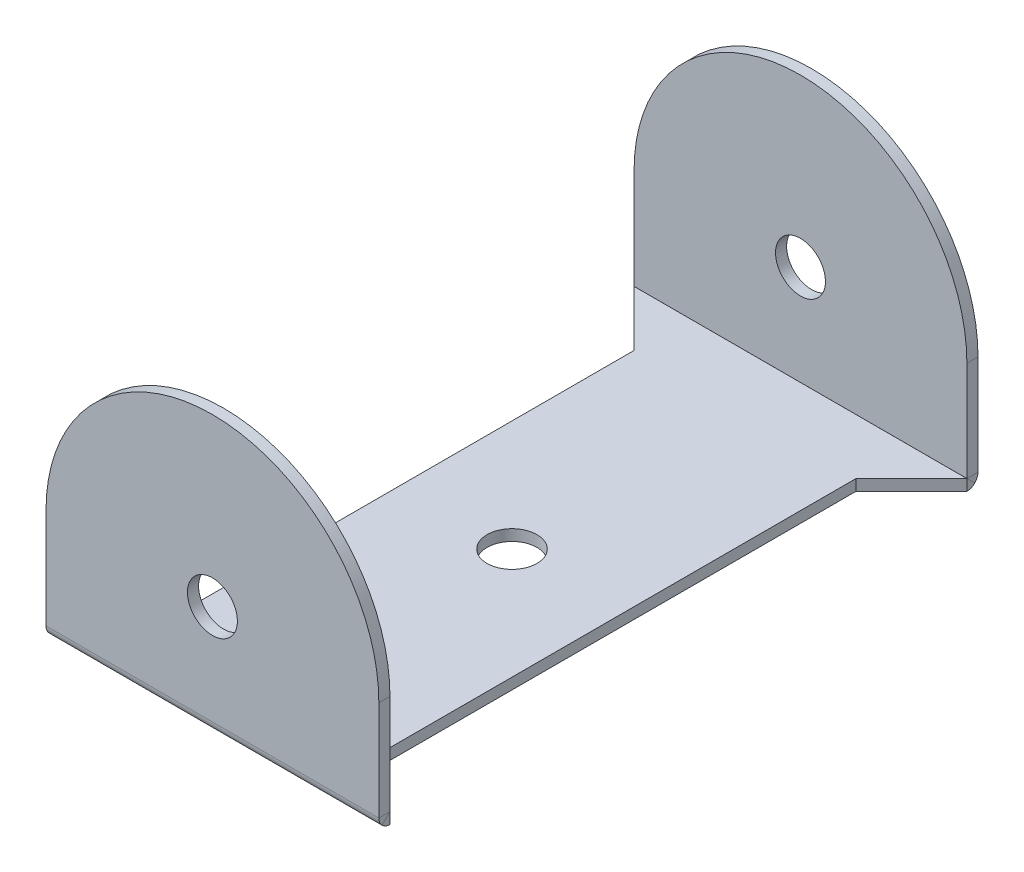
SolidWorks part; units mm, degrees
ref_plane "Front Plane" through (0, 0, 0) normal (0, 0, 1) x (1, 0, 0)
ref_plane "Top Plane" through (0, 0, 0) normal (0, 1, 0) x (1, 0, 0)
ref_plane "Right Plane" through (0, 0, 0) normal (1, 0, 0) x (0, 0, -1)
sketch "Sketch1" plane through (0, 0, 0) normal (0, 1, 0) x (1, 0, 0)
  line L0 (0, 0) -> (20, 0) construction
  line L1 (0, -21) -> (0, 21)
  line L2 (0, 21) -> (-5, 26)
  line L3 (20, -21) -> (20, 21)
  line L4 (20, 21) -> (25, 26)
  line L5 (25, 26) -> (25, 35)
  line L6 (-5, 26) -> (-5, 35)
  line L7 (25, 35) -> (-5, 35) construction
  line L8 (10, 35) -> (10, 0) construction
  line L9 (-5, -26) -> (-5, -35)
  line L10 (0, -21) -> (-5, -26)
  line L11 (20, -21) -> (25, -26)
  line L12 (25, -26) -> (25, -35)
  circle A0 centre (10, 0) radius 2.25
  circle A1 centre (10, 35) radius 2.25
  arc A2 (25, 35) -> (-5, 35) centre (10, 35) ccw
  circle A3 centre (10, -35) radius 2.25
  arc A4 (25, -35) -> (-5, -35) centre (10, -35) cw
  dimension "D4" = 15
  dimension "D7" = 4.5
  dimension "D8" = 4.5
  dimension "D1" = 20
  dimension "D2" = 21
  dimension "D3" = 21
  dimension "D5" = 26
  dimension "D6" = 26
  dimension "D9" = 35
sheet metal parameters "Sheet-Metal1" thickness 1 parameters "D1"=0.0001
base flange "Base-Flange1" sketch "Sketch1" thickness 1 reverse thickness direction yes parameters "D1"=0.0001
sketch "Sketch3" plane through (0, 1, 0) normal (0, 1, 0) x (1, 0, 0)
  line L0 (-5, 26) -> (25, 26)
  line L1 (25, -26) -> (-5, -26)
sketched bend "Sketched Bend2" parameters "D1"=0.001
bend "SketchBend3" bend radius 0.001 bend angle 90 parameters "D5"=1
bend "SketchBend4" bend radius 0 bend angle 90 parameters "D5"=2
flat pattern "Flat-Pattern1"
sketch "Bend-Lines1" plane through (0, 0, 0) normal (0, 1, 0) x (-1, 0, 0)
bend of the flat pattern "Flatten-<SketchBend3>1"
bend of the flat pattern "Flatten-<SketchBend4>1"
